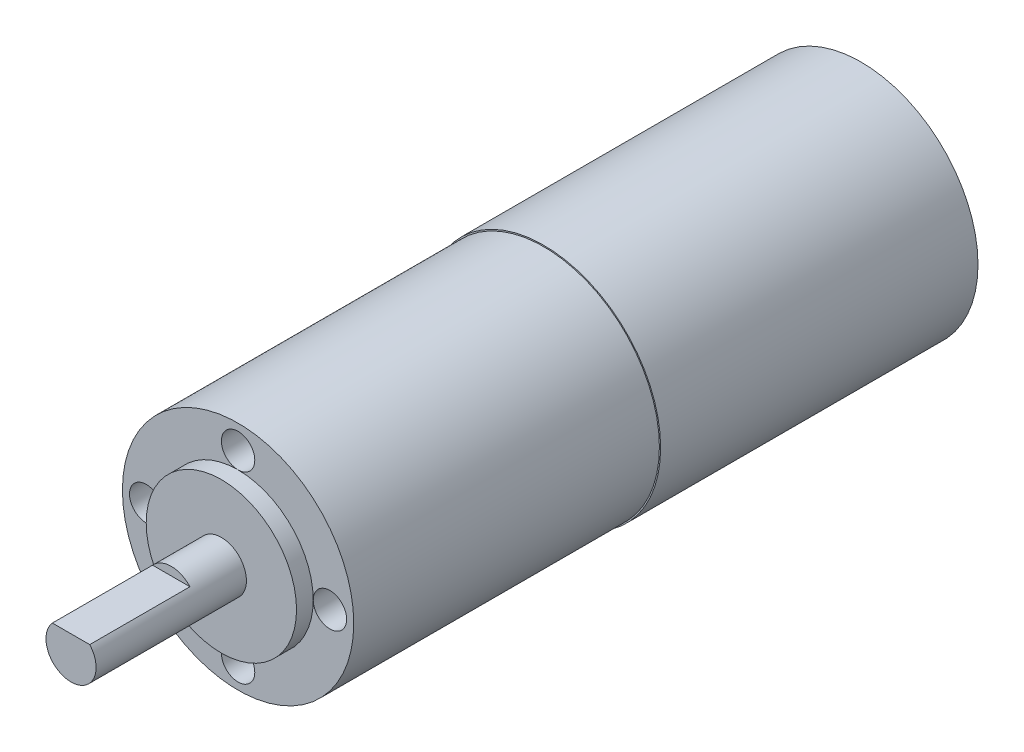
SolidWorks part; units mm, degrees
ref_plane "Front Plane" through (0, 0, 0) normal (0, 0, 1) x (1, 0, 0)
ref_plane "Top Plane" through (0, 0, 0) normal (0, 1, 0) x (1, 0, 0)
ref_plane "Right Plane" through (0, 0, 0) normal (1, 0, 0) x (0, 0, -1)
sketch "Sketch1" plane through (0, 0, 0) normal (0, 0, 1) x (1, 0, 0)
  circle A0 centre (0, 0) radius 14
  dimension "D1" = 28
extrude "Boss-Extrude1" add sketch "Sketch1" along normal blind 38
sketch "Sketch2" plane through (0, 0, 38) normal (0, 0, 1) x (1, 0, 0)
  circle A0 centre (0, 0) radius 13.85
  dimension "D1" = 27.7
extrude "Boss-Extrude2" add sketch "Sketch2" along normal blind 36.6
sketch "Sketch3" plane through (0, 0, 74.6) normal (0, 0, 1) x (1, 0, 0)
  circle A0 centre (0, 0) radius 9
  dimension "D1" = 18
extrude "Boss-Extrude3" add sketch "Sketch3" along normal blind 2
sketch "Sketch4" plane through (0, 0, 76.6) normal (0, 0, 1) x (1, 0, 0)
  circle A0 centre (0, 0) radius 3
  dimension "D1" = 6
extrude "Boss-Extrude4" add sketch "Sketch4" along normal blind 18
sketch "Sketch5" plane through (0, 0, 0) normal (1, 0, 0) x (0, 0, -1)
  line L0 (-94.6, -3) -> (-76.6, -3) construction
  line L1 (-94.6, 3) -> (-82.6, 3)
  line L2 (-94.6, 3) -> (-94.6, 2)
  line L3 (-94.6, 2) -> (-82.6, 2)
  line L4 (-82.6, 3) -> (-82.6, 2)
  dimension "D1" = 5
  dimension "D2" = 12
extrude "Cut-Extrude1" cut sketch "Sketch5" against normal through all both and the other way through all
sketch "Sketch6" plane through (0, 0, 74.6) normal (0, 0, 1) x (1, 0, 0)
  circle A0 centre (0, 0) radius 11
  circle A1 centre (0, 11) radius 2
  circle A2 centre (11, 0) radius 2
  circle A3 centre (0, -11) radius 2
  circle A4 centre (-11, 0) radius 2
  dimension "D1" = 22
  dimension "D2" = 4
extrude "Cut-Extrude2" cut sketch "Sketch6" against normal blind 18 and the other way through all contours A1 | A2 | A3 | A4
